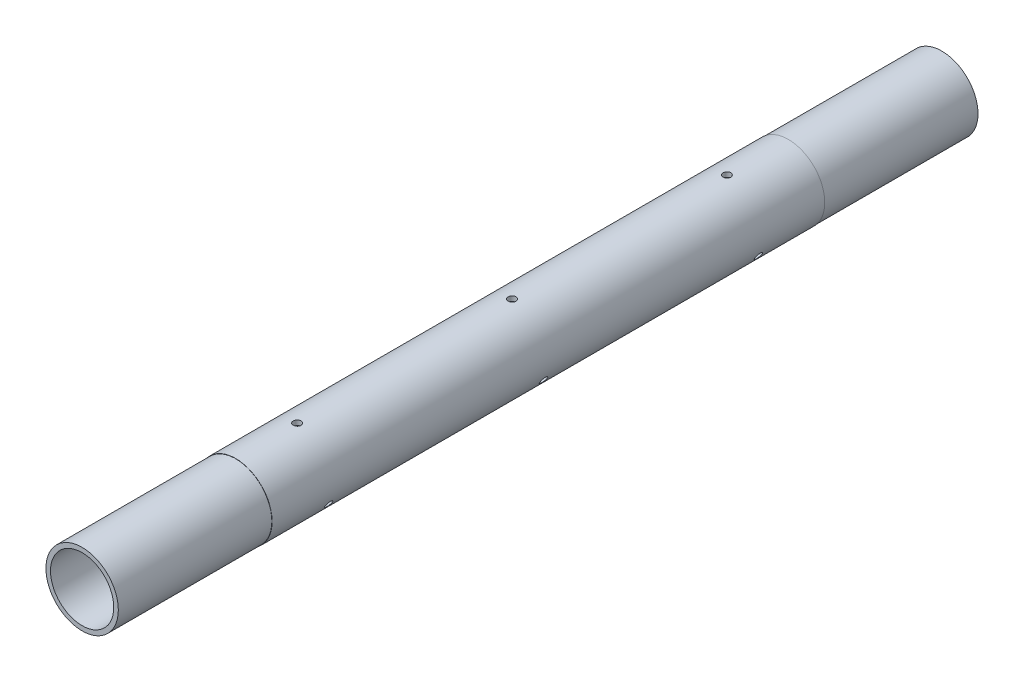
SolidWorks part; units mm, degrees
ref_plane "Front Plane" through (0, 0, 0) normal (0, 0, 1) x (1, 0, 0)
ref_plane "Top Plane" through (0, 0, 0) normal (0, 1, 0) x (1, 0, 0)
ref_plane "Right Plane" through (0, 0, 0) normal (1, 0, 0) x (0, 0, -1)
sketch "Sketch1" plane through (0, 0, 0) normal (0, 0, 1) x (1, 0, 0)
  circle A0 centre (0, 0) radius 30.1625
  circle A1 centre (0, 0) radius 26.162
  dimension "D1" = 60.325
  dimension "D2" = 52.324
extrude "Extrude1" add sketch "Sketch1" along normal mid plane 457.2
sketch "Sketch2" plane through (0, 0, -228.6) normal (0, 0, -1) x (-1, 0, 0)
  circle A0 centre (0, 0) radius 29.9466
  circle A1 centre (0, 0) radius 26.162
  dimension "D1" = 52.324
  dimension "D2" = 59.8932
extrude "Extrude2" add sketch "Sketch2" along normal blind 127
sketch "Sketch3" plane through (0, 0, 228.6) normal (0, 0, 1) x (1, 0, 0)
  circle A0 centre (0, 0) radius 26.162
  circle A1 centre (0, 0) radius 29.9466
  dimension "D1" = 59.8932
  dimension "D2" = 52.324
extrude "Extrude3" add sketch "Sketch3" along normal blind 127
ref_plane "Plane1" through (0, 30.226, 0) normal (0, 1, 0) x (-1, 0, 0)
sketch "Sketch4" plane through (0, 30.226, 0) normal (0, 1, 0) x (-1, 0, 0)
  circle A0 centre (0, 0) radius 3.2004
  dimension "D1" = 6.4008
extrude "Cut-Extrude1" cut sketch "Sketch4" against normal up to next
pattern_circular "CirPattern1" count 3 every 120 about axis through (0, 0, 228.6) along (0, 0, -1) of "Cut-Extrude1"
pattern_linear "LPattern1" count 2 spacing 177.8 along (0, 0, 1) of "CirPattern1", "Cut-Extrude1"
pattern_linear "LPattern2" count 2 spacing 177.8 along (0, 0, -1) of "CirPattern1", "Cut-Extrude1"
ref_plane "shaft center plane" through (0, 0, 0) normal (0, 0, -1) x (-1, 0, 0)
